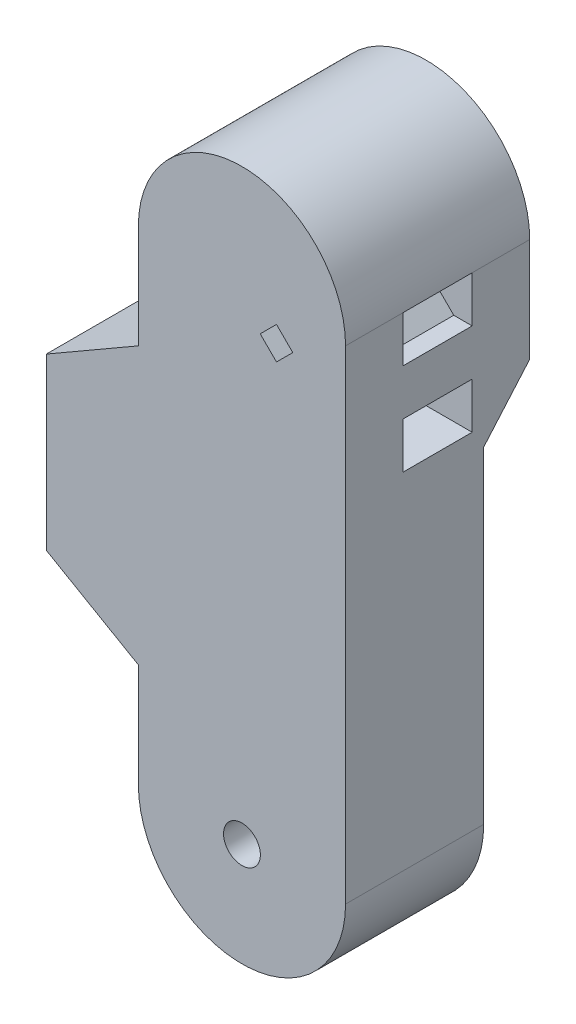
SolidWorks part; units mm, degrees
ref_plane "前视基准面" through (0, 0, 0) normal (0, 0, 1) x (1, 0, 0)
ref_plane "上视基准面" through (0, 0, 0) normal (0, 1, 0) x (1, 0, 0)
ref_plane "右视基准面" through (0, 0, 0) normal (1, 0, 0) x (0, 0, -1)
sketch "草图1" plane through (0, 0, 0) normal (0, 0, 1) x (1, 0, 0)
  line L0 (0, -52.5) -> (0, 52.5) construction
  line L1 (-22.5, -52.5) -> (-22.5, 52.5)
  line L2 (22.5, -52.5) -> (22.5, 52.5)
  line L3 (-22.5, 30) -> (-42.5, 18.453)
  line L4 (-42.5, 18.453) -> (-42.5, -18.453)
  line L5 (-42.5, 0) -> (0, 0) construction
  line L6 (-22.5, -30) -> (-42.5, -18.453)
  arc A0 (-22.5, -52.5) -> (22.5, -52.5) centre (0, -52.5) ccw
  arc A1 (22.5, 52.5) -> (-22.5, 52.5) centre (0, 52.5) ccw
  point P2 (0, 0)
  dimension "D2" = 22.5
  dimension "D1" = 105
  dimension "D3" = 60
  dimension "D4" = 20
  dimension "D5" = 30
extrude "凸台-拉伸1" add sketch "草图1" along normal blind 40 contours L6 L1 L3 L4 | L2 A1 L1 A0
sketch "草图3" plane through (0, 0, 0) normal (0, 1, 0) x (1, 0, 0)
  line L0 (22.5, -50) -> (22.5, -40)
  line L1 (22.5, -40) -> (-22.5, -40)
  line L2 (-22.5, -40) -> (-22.5, -50)
  arc A0 (-22.5, -50) -> (22.5, -50) centre (0, -50) ccw
  dimension "D1" = 45
  dimension "D2" = 10
  dimension "D3" = 10
sketch "草图15" plane through (-42.5, 0, 0) normal (-1, 0, 0) x (0, 0, 1)
  line L2 (0, -75) -> (40, -75) construction
  line L3 (10, -75) -> (0, -75)
  line L4 (0, -75) -> (0, 18.453)
  line L9 (10, -75) -> (10, 18.453)
  line L12 (0, 18.453) -> (0, 30)
  line L14 (0, 30) -> (10, 18.453)
  line L15 (40, 18.453) -> (0, 18.453) construction
  dimension "D1" = 10
extrude "切除-拉伸3" cut sketch "草图15" against normal through all
ref_plane "基准面1" through (0, 0, 20) normal (0, 0, -1) x (-1, 0, 0)
sketch "草图16" plane through (0, 0, 20) normal (0, 0, -1) x (-1, 0, 0)
  line L0 (-22.5, 52.5) -> (9.5, 52.5)
  line L1 (9.5, 52.5) -> (2.5, 45.5)
  line L2 (2.5, 45.5) -> (-3.9645, 45.5)
  line L3 (-3.9645, 45.5) -> (-7.5, 49.0355)
  line L4 (-7.5, 49.0355) -> (-11.0355, 45.5)
  line L5 (-11.0355, 45.5) -> (-15.5, 45.5)
  line L6 (-15.5, 45.5) -> (-18.5, 42.5)
  line L7 (-18.5, 42.5) -> (-22.5, 42.5)
  line L8 (-22.5, 30) -> (-22.5, 52.5) construction
  line L9 (-22.5, 42.5) -> (-22.5, 52.5)
  line L10 (-22.5, 37.5) -> (7.5, 37.5) construction
  line L11 (-22.5, 32.5) -> (-22.5, 22.5)
  line L12 (-18.5, 32.5) -> (-22.5, 32.5)
  line L13 (-15.5, 29.5) -> (-18.5, 32.5)
  line L14 (-11.0355, 29.5) -> (-15.5, 29.5)
  line L15 (-7.5, 25.9645) -> (-11.0355, 29.5)
  line L16 (-3.9645, 29.5) -> (-7.5, 25.9645)
  line L17 (2.5, 29.5) -> (-3.9645, 29.5)
  line L18 (9.5, 22.5) -> (2.5, 29.5)
  line L19 (-22.5, 22.5) -> (9.5, 22.5)
  line L20 (-11.0355, 45.5) -> (-7.5, 41.9645)
  line L21 (-7.5, 41.9645) -> (-3.9645, 45.5)
  line L22 (-7.5, 33.0355) -> (-3.9645, 29.5)
  line L23 (-11.0355, 29.5) -> (-7.5, 33.0355)
  dimension "D1" = 10
  dimension "D2" = 7
  dimension "D3" = 7
  dimension "D4" = 90
  dimension "D5" = 32
  dimension "D6" = 5
  dimension "D7" = 15
  dimension "D8" = 4
  dimension "D9" = 5
  dimension "D10" = 15
extrude "切除-拉伸4" cut sketch "草图16" against normal mid plane 15 contours L11 L19 L18 L17 L16 L15 L14 L13 L12 | L9 L0 L1 L2 L3 L4 L5 L6 L7
sketch "草图18" plane through (0, 0, 0) normal (0, 0, -1) x (-1, 0, 0)
  line L0 (-7.5, 49.0355) -> (-11.0355, 45.5)
  line L1 (-11.0355, 45.5) -> (-7.5, 41.9645)
  line L2 (-7.5, 41.9645) -> (-3.9645, 45.5)
  line L3 (-3.9645, 45.5) -> (-7.5, 49.0355)
extrude "切除-拉伸5" cut sketch "草图18" against normal through all both and the other way through all
sketch "草图19" plane through (0, 0, 10) normal (0, 0, -1) x (-1, 0, 0)
  circle A0 centre (0, -52.5) radius 4
  dimension "D1" = 8
extrude "切除-拉伸6" cut sketch "草图19" against normal through all
